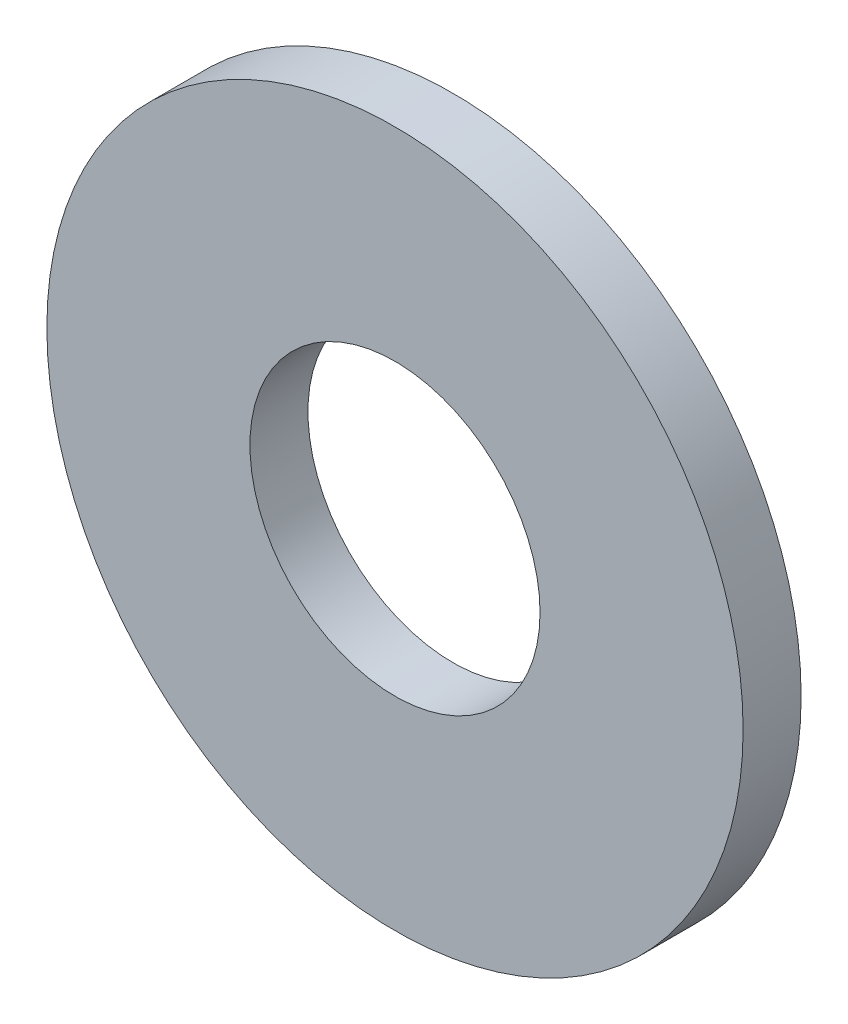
SolidWorks part; units mm, degrees
ref_plane "Plan de face" through (0, 0, 0) normal (0, 0, 1) x (1, 0, 0)
ref_plane "Plan de dessus" through (0, 0, 0) normal (0, 1, 0) x (1, 0, 0)
ref_plane "Plan de droite" through (0, 0, 0) normal (1, 0, 0) x (0, 0, -1)
sketch "Esquisse1" plane through (0, 0, 0) normal (0, 1, 0) x (1, 0, 0)
  line L0 (3.5, -1) -> (7, -1)
  line L1 (7, -1) -> (7, 0)
  line L2 (7, 0) -> (3.5, 0)
  line L3 (3.5, 0) -> (3.5, -1)
  line L4 (1, 0) -> (1, -1.2) construction
  dimension "D1" = 3.5
  dimension "D2" = 1
  dimension "D3" = 2.5
revolve "Révolution1" add sketch "Esquisse1" angle 360 about L4
